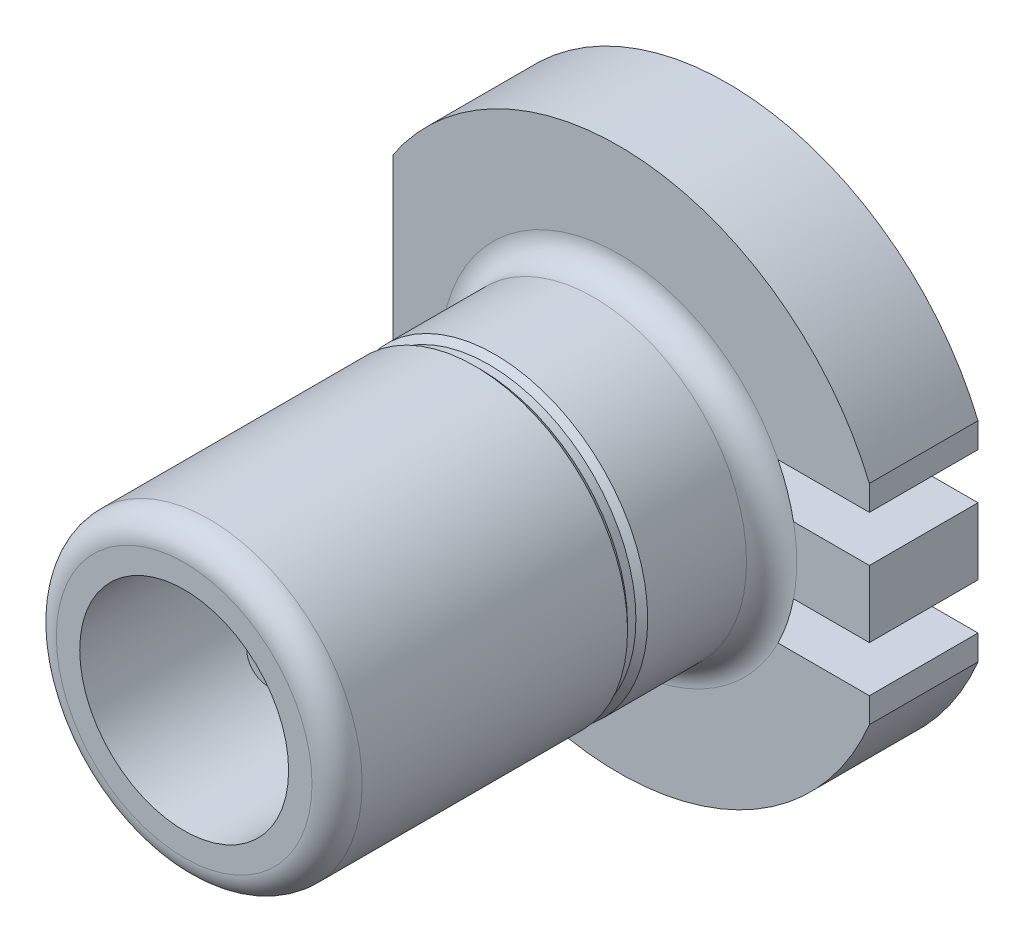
SolidWorks part; units mm, degrees
ref_plane "Front Plane" through (0, 0, 0) normal (0, 0, 1) x (1, 0, 0)
ref_plane "Top Plane" through (0, 0, 0) normal (0, 1, 0) x (1, 0, 0)
ref_plane "Right Plane" through (0, 0, 0) normal (1, 0, 0) x (0, 0, -1)
other "Center of Mass"
sketch "Sketch1" plane through (0, 0, 0) normal (0, 0, 1) x (1, 0, 0)
  line L0 (-2.7, 1.809) -> (-2.7, -1.809)
  line L1 (3, 1.25) -> (3, 0.95)
  line L2 (3, -0.95) -> (3, -1.25)
  line L3 (0.4472, 0.95) -> (3, 0.95)
  line L5 (0.4472, -0.95) -> (3, -0.95)
  line L8 (3, 0.4) -> (1.3, 0.4)
  line L9 (3, 0.4) -> (3, -0.4)
  line L10 (3, -0.4) -> (1.3, -0.4)
  line L11 (1.3, 0.4) -> (1.3, -0.4)
  arc A0 (0.4472, 0.95) -> (0.4472, -0.95) centre (0, 0) ccw
  arc A1 (-2.7, -1.809) -> (3, -1.25) centre (0, 0) ccw
  arc A2 (3, 1.25) -> (-2.7, 1.809) centre (0, 0) ccw
  point P10 (1.3, 0)
  dimension "D1" = 2.1
  dimension "D2" = 6.5
  dimension "D3" = 2.7
  dimension "D4" = 3
  dimension "D5" = 0.95
  dimension "D6" = 0.95
  dimension "D7" = 0.8
  dimension "D8" = 1.3
extrude "Boss-Extrude1" add sketch "Sketch1" along normal blind 1.3
ref_point "Point1"
ref_axis "Axis1" through (0, 0, 1.3) along (0, 0, -1)
sketch "Sketch2" plane through (0, 0, 0) normal (0, 1, 0) x (1, 0, 0)
  line L0 (0, -1.3) -> (0, -6.5)
  line L1 (0, -1.3) -> (0, 1.5529) construction
  line L2 (0, -6.5) -> (1.53, -6.5)
  line L3 (1.83, -6.2) -> (1.83, -3.0238)
  line L4 (0, -1.3) -> (2.13, -1.3)
  line L6 (1.83, -3.0238) -> (1.7593, -2.9531)
  line L7 (1.7593, -2.9531) -> (1.7593, -2.8531)
  line L8 (1.7593, -2.8531) -> (1.83, -2.7824)
  line L9 (1.83, -2.7824) -> (1.83, -1.6)
  arc A0 (2.13, -1.3) -> (1.83, -1.6) centre (2.13, -1.6) ccw
  arc A1 (1.83, -6.2) -> (1.53, -6.5) centre (1.53, -6.2) cw
  point P10 (1.83, -6.5)
  dimension "D3" = 0.3
  dimension "D4" = 0.3
  dimension "D1" = 5.2
  dimension "D2" = 1.83
  dimension "D5" = 0.1
  dimension "D6" = 0.1
revolve "Revolve1" add sketch "Sketch2" angle 360 about axis through (0, 0, 1.3) along (0, 0, -1)
sketch "Sketch3" plane through (0, 0, 6.5) normal (0, 0, 1) x (1, 0, 0)
  circle A0 centre (0, 0) radius 1.25
  dimension "D1" = 2.5
extrude "Cut-Extrude1" cut sketch "Sketch3" against normal blind 5
sketch "Sketch4" plane through (0, 0, 1.5) normal (0, 0, 1) x (1, 0, 0)
  circle A0 centre (0, 0) radius 0.25
  dimension "D1" = 0.5
extrude "Boss-Extrude2" add sketch "Sketch4" along normal blind 4
